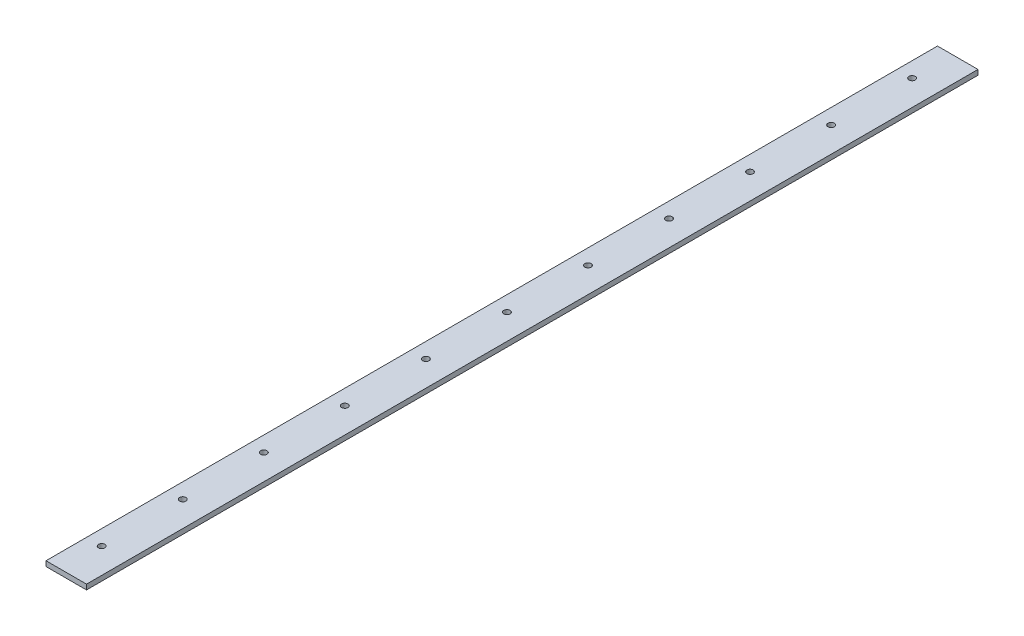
SolidWorks part; units mm, degrees
ref_plane "Front Plane" through (0, 0, 0) normal (0, 0, 1) x (1, 0, 0)
ref_plane "Top Plane" through (0, 0, 0) normal (0, 1, 0) x (1, 0, 0)
ref_plane "Right Plane" through (0, 0, 0) normal (1, 0, 0) x (0, 0, -1)
sketch "Sketch1" plane through (0, 0, 0) normal (0, 0, 1) x (1, 0, 0)
  line L1 (25.4, -3.175) -> (-25.4, -3.175)
  line L2 (25.4, -3.175) -> (25.4, 3.175)
  line L3 (25.4, 3.175) -> (-25.4, 3.175)
  line L4 (-25.4, -3.175) -> (-25.4, 3.175)
  line L5 (25.4, -3.175) -> (-25.4, 3.175) construction
  line L6 (25.4, 3.175) -> (-25.4, -3.175) construction
  point P0 (0, 0)
  dimension "D1" = 6.35
  dimension "D2" = 50.8
extrude "Extrude1" add sketch "Sketch1" along normal blind 1117.6
sketch "Sketch3" plane through (0, 3.175, 0) normal (0, 1, 0) x (1, 0, 0)
  line L0 (-25.4, -1117.6) -> (-25.4, 0) construction
  line L1 (25.4, 0) -> (-25.4, 0) construction
  circle A0 centre (-6.35, -50.8) radius 3.9751
  circle A1 centre (-6.35, -152.4) radius 3.9751
  circle A2 centre (-6.35, -355.6) radius 3.9751
  circle A3 centre (-6.35, -254) radius 3.9751
  circle A4 centre (-6.35, -660.4) radius 3.9751
  circle A5 centre (-6.35, -558.8) radius 3.9751
  circle A6 centre (-6.35, -457.2) radius 3.9751
  circle A7 centre (-6.35, -762) radius 3.9751
  circle A8 centre (-6.35, -863.6) radius 3.9751
  circle A9 centre (-6.35, -965.2) radius 3.9751
  circle A10 centre (-6.35, -1066.8) radius 3.9751
  dimension "D3" = 7.9502
  dimension "D6" = 7.9502
  dimension "D9" = 7.9502
  dimension "D10" = 7.9502
  dimension "D14" = 7.9502
  dimension "D18" = 7.9502
  dimension "D21" = 7.9502
  dimension "D24" = 7.9502
  dimension "D27" = 7.9502
  dimension "D30" = 7.9502
  dimension "D33" = 7.9502
  dimension "D1" = 19.05
  dimension "D2" = 50.8
  dimension "D4" = 19.05
  dimension "D5" = 101.6
  dimension "D7" = 101.6
  dimension "D8" = 19.05
  dimension "D11" = 101.6
  dimension "D12" = 19.05
  dimension "D13" = 101.6
  dimension "D15" = 19.05
  dimension "D16" = 101.6
  dimension "D17" = 19.05
  dimension "D19" = 101.6
  dimension "D20" = 19.05
  dimension "D22" = 101.6
  dimension "D23" = 19.05
  dimension "D25" = 19.05
  dimension "D26" = 101.6
  dimension "D28" = 19.05
  dimension "D29" = 101.6
  dimension "D31" = 101.6
  dimension "D32" = 19.05
extrude "Extrude3" cut sketch "Sketch3" against normal blind 6.35
